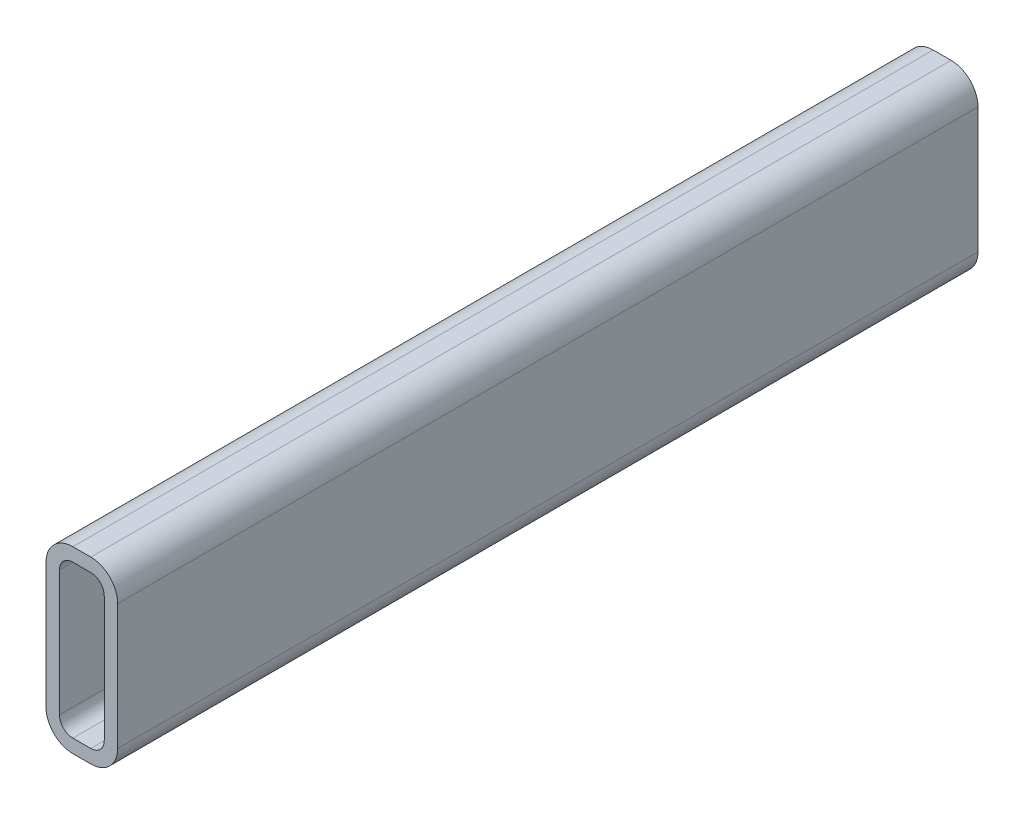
SolidWorks part; units mm, degrees
ref_plane "Front Plane" through (0, 0, 0) normal (0, 0, 1) x (1, 0, 0)
ref_plane "Top Plane" through (0, 0, 0) normal (0, 1, 0) x (1, 0, 0)
ref_plane "Right Plane" through (0, 0, 0) normal (1, 0, 0) x (0, 0, -1)
sketch "Sketch1" plane through (0, 0, 0) normal (0, 0, 1) x (1, 0, 0)
  line B0 (9.525, 63.5) -> (15.875, 63.5)
  arc B1 (25.4, 53.975) -> (15.875, 63.5) centre (15.875, 53.975) ccw
  line B2 (25.4, 53.975) -> (25.4, 9.525)
  arc B3 (15.875, 0) -> (25.4, 9.525) centre (15.875, 9.525) ccw
  line B4 (15.875, 0) -> (9.525, 0)
  arc B5 (0, 9.525) -> (9.525, 0) centre (9.525, 9.525) ccw
  line B6 (0, 9.525) -> (0, 53.975)
  arc B7 (9.525, 63.5) -> (0, 53.975) centre (9.525, 53.975) ccw
  line B8 (9.525, 58.7375) -> (15.875, 58.7375)
  arc B9 (20.6375, 53.975) -> (15.875, 58.7375) centre (15.875, 53.975) ccw
  line B10 (20.6375, 53.975) -> (20.6375, 9.525)
  arc B11 (15.875, 4.7625) -> (20.6375, 9.525) centre (15.875, 9.525) ccw
  line B12 (15.875, 4.7625) -> (9.525, 4.7625)
  arc B13 (4.7625, 9.525) -> (9.525, 4.7625) centre (9.525, 9.525) ccw
  line B14 (4.7625, 9.525) -> (4.7625, 53.975)
  arc B15 (9.525, 58.7375) -> (4.7625, 53.975) centre (9.525, 53.975) ccw
sketch_block_instance "HSS2.5x1x0.1875-1"
sketch_block "HSS2.5x1x0.1875"
extrude "Boss-Extrude1" add sketch "Sketch1" along normal blind 304.8
